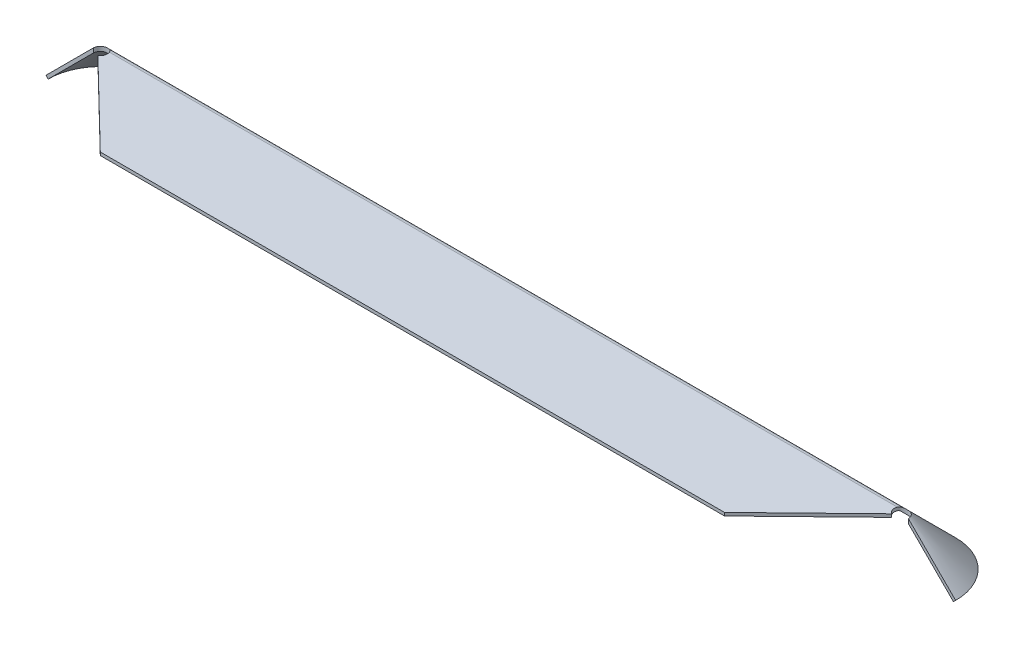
SolidWorks part; units mm, degrees
ref_plane "Front" through (0, 0, 0) normal (0, 0, 1) x (1, 0, 0)
ref_plane "Top" through (0, 0, 0) normal (0, 1, 0) x (1, 0, 0)
ref_plane "Right" through (0, 0, 0) normal (1, 0, 0) x (0, 0, -1)
sketch "Sketch1" plane through (0, 0, 0) normal (0, 1, 0) x (1, 0, 0)
  line L0 (0, 0) -> (-120, 0)
  line L1 (-120, 0) -> (-120, -50)
  line L2 (154, 35) -> (-154, 35)
  line L3 (-155, 34) -> (-155, -50)
  line L4 (0, 35) -> (0, 0) construction
  line L5 (-120, -50) -> (-155, -50)
  line L6 (0, 35) -> (-155, 35) construction
  line L7 (-155, 35) -> (-155, -50) construction
  line L8 (120, -50) -> (155, -50)
  line L9 (155, 34) -> (155, -50)
  line L10 (120, 0) -> (120, -50)
  line L11 (0, 0) -> (120, 0)
  arc A0 (-154, 35) -> (-155, 34) centre (-154, 34) ccw
  arc A1 (154, 35) -> (155, 34) centre (154, 34) cw
  dimension "D4" = 1
  dimension "D1" = 50
  dimension "D2" = 120
  dimension "D3" = 35
base flange "Base-Flange1" sketch "Sketch1" thickness 1.2 reverse thickness direction no parameters "D1"=1
sketch "Sketch6" plane through (0, 0, 50) normal (0, 0, 1) x (1, 0, 0)
  line L0 (-155, -1.2) -> (-172.6777, -18.8777)
  line L1 (-155, -1.2) -> (-120, -1.2) construction
  dimension "D1" = 25
  dimension "D2" = 135
swept flange "Swept Flange2" thickness 1.2 parameters "D1"=1.2
sketch "Sketch20" plane through (-155, -1.2, 50) normal (0, -1, 0) x (0, 0, 1)
  line L0 (0, 0) -> (-84, 0) construction
  line L1 (0, 0) -> (-84, 0)
  line L2 (-85, -1) -> (-85, -309) construction
  line L3 (-85, -1) -> (-85, -309)
  line L4 (-84, -310) -> (0, -310) construction
  line L5 (-84, -310) -> (0, -310)
  arc A0 (-84, 0) -> (-85, -1) centre (-84, -1) ccw construction
  arc A1 (-84, 0) -> (-85, -1) centre (-84, -1) ccw
  arc A2 (-85, -309) -> (-84, -310) centre (-84, -309) ccw construction
  arc A3 (-85, -309) -> (-84, -310) centre (-84, -309) ccw
other "Sweptbend1_1" parameters "D1"=1.2, "D4"=315, "D5"=1
other "Sweptbend2_1" parameters "D1"=1.2, "D4"=90, "D5"=2
other "Sweptbend2_2" parameters "D1"=1.2, "D4"=90, "D5"=3
sketch "Sketch22" plane through (0, 0, 0) normal (0, 1, 0) x (1, 0, 0)
  line L0 (-120, 0) -> (-152.6166, 31.6847)
  line L1 (-156.6971, 34) -> (-174.8718, 34)
  line L2 (-174.8718, -50) -> (-174.8718, 34) construction
  line L4 (0, 35) -> (-154, 35) construction
  arc A0 (-152.6166, 31.6847) -> (-156.6971, 34) centre (-154, 34) ccw
  arc A2 (-154, 36.6971) -> (-156.6971, 34) centre (-154, 34) ccw construction
  dimension "D1" = 174.8718
  dimension "D2" = 32.6166
  dimension "D4" = 4.0804
extrude "Cut-Extrude2" cut sketch "Sketch22" against normal through all and the other way through all
mirror "Mirror2" about plane through (0, 0, 0) normal (1, 0, 0) of "Cut-Extrude2"
sketch "Bend-Lines1" [suppressed] plane through (0, 0, 0) normal (0, 1, 0) x (1, 0, 0)
sketch "Bounding-Box1" [suppressed] plane through (0, 0, 0) normal (0, 1, 0) x (1, 0, 0)
sheet metal parameters "Sheet-Metal1" thickness 1.2 parameters "D1"=1
flat pattern "Flat-Pattern1"
sketch "Bend-Lines2" plane through (0, 0, 0) normal (0, 1, 0) x (1, 0, 0)
  line L0 (155.7069, 34) -> (155.7069, -50) construction
  line L1 (-154, 35.7069) -> (154, 35.7069) construction
  line L2 (-154.7071, 34.7071) -> (-173.8815, 53.8815) construction
  line L3 (-155.7069, -50) -> (-155.7069, 34) construction
  line L4 (154.7071, 34.7071) -> (173.8815, 53.8815) construction
  arc A0 (155.7069, 34) -> (154, 35.7069) centre (154, 34) ccw construction
  arc A1 (-154, 35.7069) -> (-155.7069, 34) centre (-154, 34) ccw construction
sketch3d "Bounding-Box2" [suppressed]
  line L0 (-28.1167, -84, -1.2) -> (336.1167, -84, -1.2) construction
  line L1 (-28.1167, 28.1167, -1.2) -> (336.1167, 28.1167, -1.2) construction
  line L2 (-28.1167, -84, -1.2) -> (-28.1167, 28.1167, -1.2) construction
  line L3 (336.1167, -84, -1.2) -> (336.1167, 28.1167, -1.2) construction
bend of the flat pattern "Flatten-<Sweptbend1_1>1"
bend of the flat pattern "Flatten-<Sweptbend2_1>1"
bend of the flat pattern "Flatten-<Sweptbend2_2>1"
sheet metal parameters "Sheet-Metal2" thickness 1.2 parameters "D1"=1
flat pattern "Flat-Pattern1"
sketch "Bend-Lines2" plane through (0, 0, 0) normal (0, 1, 0) x (1, 0, 0)
  line L0 (155.7069, 34) -> (155.7069, -50) construction
  line L1 (-154, 35.7069) -> (154, 35.7069) construction
  line L2 (-154.7071, 34.7071) -> (-173.8815, 53.8815) construction
  line L3 (-155.7069, -50) -> (-155.7069, 34) construction
  line L4 (154.7071, 34.7071) -> (173.8815, 53.8815) construction
  arc A0 (155.7069, 34) -> (154, 35.7069) centre (154, 34) ccw construction
  arc A1 (-154, 35.7069) -> (-155.7069, 34) centre (-154, 34) ccw construction
sketch3d "Bounding-Box2" [suppressed]
  line L0 (-28.1167, -84, 0) -> (336.1167, -84, 0) construction
  line L1 (-28.1167, 28.1167, 0) -> (336.1167, 28.1167, 0) construction
  line L2 (-28.1167, -84, 0) -> (-28.1167, 28.1167, 0) construction
  line L3 (336.1167, -84, 0) -> (336.1167, 28.1167, 0) construction
bend of the flat pattern "Flatten-<Sweptbend1_1>1"
bend of the flat pattern "Flatten-<Sweptbend2_1>1"
bend of the flat pattern "Flatten-<Sweptbend2_2>2"
sheet metal parameters "Sheet-Metal4" thickness 1.2 parameters "D1"=1
flat pattern "Flat-Pattern1"
sketch "Bend-Lines2" plane through (0, 0, 0) normal (0, 1, 0) x (1, 0, 0)
  line L0 (155.7069, 34) -> (155.7069, -50) construction
  line L1 (-154, 35.7069) -> (154, 35.7069) construction
  line L2 (-154.7071, 34.7071) -> (-173.8815, 53.8815) construction
  line L3 (-155.7069, -50) -> (-155.7069, 34) construction
  line L4 (154.7071, 34.7071) -> (173.8815, 53.8815) construction
  arc A2 (155.7069, 34) -> (154, 35.7069) centre (154, 34) ccw construction
  arc A3 (-154, 35.7069) -> (-155.7069, 34) centre (-154, 34) ccw construction
sketch3d "Bounding-Box2" [suppressed]
  line L0 (336.1167, -34, 0) -> (-28.1167, -34, 0) construction
  line L1 (336.1167, 28.1167, 0) -> (-28.1167, 28.1167, 0) construction
  line L2 (336.1167, -34, 0) -> (336.1167, 28.1167, 0) construction
  line L3 (-28.1167, -34, 0) -> (-28.1167, 28.1167, 0) construction
bend of the flat pattern "Flatten-<Sweptbend1_1>1"
bend of the flat pattern "Flatten-<Sweptbend2_1>1"
bend of the flat pattern "Flatten-<Sweptbend2_2>2"
